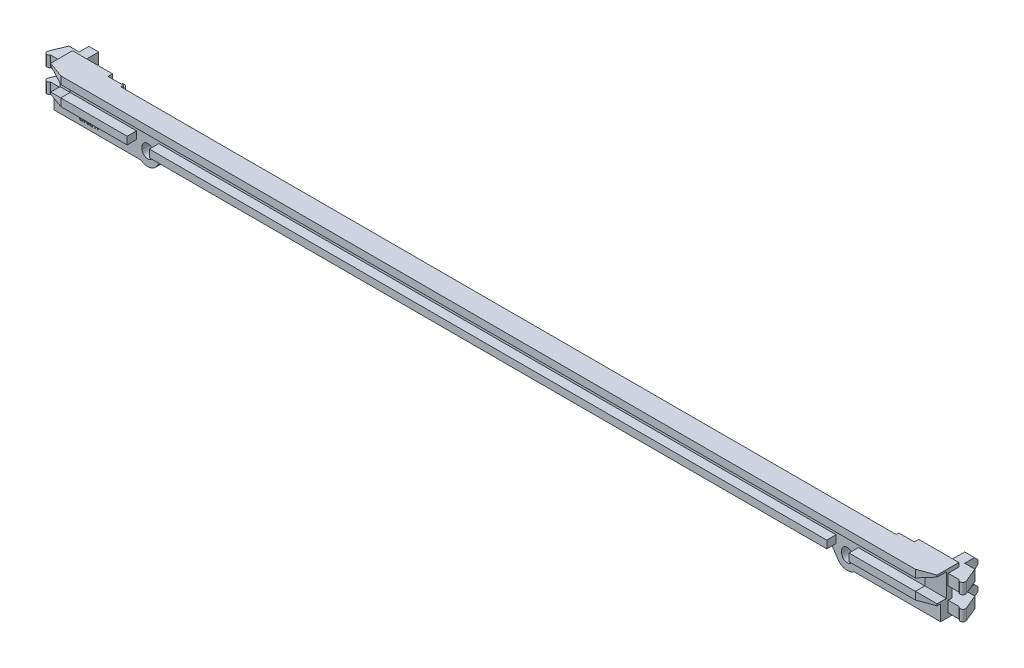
SolidWorks part; units mm, degrees
ref_plane "前视基准面" through (0, 0, 0) normal (0, 0, 1) x (1, 0, 0)
ref_plane "上视基准面" through (0, 0, 0) normal (0, 1, 0) x (1, 0, 0)
ref_plane "右视基准面" through (0, 0, 0) normal (1, 0, 0) x (0, 0, -1)
sketch "草图1" plane through (0, 0, 0) normal (0, 0, 1) x (1, 0, 0)
  line L0 (-73.0423, -1.25) -> (73.0423, -1.25)
  line L1 (-99.65, 4.75) -> (99.65, 4.75)
  line L2 (-99.65, 4.75) -> (-99.65, -4.75)
  line L3 (-99.65, -4.75) -> (-80.15, -4.75)
  line L4 (99.65, 4.75) -> (99.65, -4.75)
  line L5 (-99.65, 4.75) -> (99.65, -4.75) construction
  line L6 (-99.65, -4.75) -> (99.65, 4.75) construction
  line L7 (0, 0) -> (0, 14.6466) construction
  line L8 (-75.5403, -2.5887) -> (-76.5683, -4.1344)
  line L9 (-78.65, -1.75) -> (-78.65, -2.75) construction
  line L10 (80.15, -4.75) -> (99.65, -4.75)
  line L11 (75.5403, -2.5887) -> (76.5683, -4.1344)
  line L12 (-78.65, -2) -> (-78.65, -2.5) construction
  line L13 (-77.4, -2) -> (-77.4, -2.5)
  line L14 (-79.9, -2) -> (-79.9, -2.5)
  line L15 (78.65, -2) -> (78.65, -2.5) construction
  line L16 (77.4, -2) -> (77.4, -2.5)
  line L17 (79.9, -2) -> (79.9, -2.5)
  arc A0 (80.15, -4.75) -> (76.5683, -4.1344) centre (78.65, -2.75) cw
  arc A1 (-80.15, -4.75) -> (-76.5683, -4.1344) centre (-78.65, -2.75) ccw
  arc A2 (-77.4, -2) -> (-79.9, -2) centre (-78.65, -2) ccw
  arc A3 (-79.9, -2.5) -> (-77.4, -2.5) centre (-78.65, -2.5) ccw
  arc A4 (77.4, -2) -> (79.9, -2) centre (78.65, -2) cw
  arc A5 (79.9, -2.5) -> (77.4, -2.5) centre (78.65, -2.5) cw
  arc A6 (75.5403, -2.5887) -> (73.0423, -1.25) centre (73.0423, -4.25) ccw
  arc A7 (-75.5403, -2.5887) -> (-73.0423, -1.25) centre (-73.0423, -4.25) cw
  point P0 (0, 0)
  point P12 (-78.65, -2.25)
  point P19 (-78.65, -2.25)
  point P24 (-78.65, -0.75)
  point P25 (-78.65, -3.75)
  point P31 (78.65, -2.25)
  point P36 (74.65, -1.25)
  point P39 (-74.65, -1.25)
  dimension "D5" = 2.5
  dimension "D8" = 21
  dimension "D11" = 3
  dimension "D9" = 7.5
  dimension "D1" = 199.3
  dimension "D2" = 9.5
  dimension "D3" = 2.5
  dimension "D4" = 3
  dimension "D6" = 5.5
  dimension "D7" = 25
  dimension "D10" = 6
extrude "凸台-拉伸1" add sketch "草图1" along normal blind 2.5
sketch "草图3" plane through (0, 0, 2.5) normal (0, 0, 1) x (1, 0, 0)
  line L0 (99.65, -4.75) -> (99.65, 4.75) construction
  line L1 (-99.65, 4.75) -> (99.65, 4.75)
  line L2 (-99.65, 4.75) -> (-99.65, 3.05)
  line L3 (-99.65, 3.05) -> (99.65, 3.05)
  line L4 (99.65, 4.75) -> (99.65, 3.05)
  line L5 (-99.65, 4.75) -> (-99.65, -4.75) construction
  line L6 (-99.65, 0.45) -> (-81.15, 0.45)
  line L7 (-99.65, 0.45) -> (-99.65, -1.25)
  line L8 (-99.65, -1.25) -> (-81.15, -1.25)
  line L9 (99.65, 0.45) -> (99.65, -1.25)
  line L10 (-73.0423, -1.25) -> (73.0423, -1.25) construction
  line L11 (-81.15, 0.45) -> (-81.15, -1.25)
  line L12 (-76.15, 0.45) -> (-76.15, -1.25)
  line L13 (-76.15, 0.45) -> (76.15, 0.45)
  line L14 (-76.15, -1.25) -> (76.15, -1.25)
  line L15 (76.15, 0.45) -> (76.15, -1.25)
  line L16 (81.15, 0.45) -> (81.15, -1.25)
  line L17 (81.15, 0.45) -> (99.65, 0.45)
  line L18 (81.15, -1.25) -> (99.65, -1.25)
  dimension "D1" = 1.7
  dimension "D2" = 1.7
  dimension "D3" = 18.5
  dimension "D4" = 5
  dimension "D5" = 5
  dimension "D6" = 18.5
extrude "凸台-拉伸2" add sketch "草图3" along normal blind 2.1
sketch "草图4" plane through (0, 0, 0) normal (0, 0, -1) x (-1, 0, 0)
  line L0 (-99.65, 4.75) -> (99.65, 4.75) construction
  line L1 (-78.15, 3.25) -> (-52.9333, 3.25)
  line L2 (-78.15, 3.25) -> (-78.15, 0.15)
  line L3 (-78.15, 0.15) -> (-52.9333, 0.15)
  line L4 (-52.9333, 3.25) -> (-52.9333, 0.15)
  line L5 (-78.15, 3.25) -> (-52.9333, 0.15) construction
  line L6 (-78.15, 0.15) -> (-52.9333, 3.25) construction
  line L7 (73.0423, -1.25) -> (-73.0423, -1.25) construction
  line L8 (-51.9333, 3.25) -> (-26.7167, 3.25)
  line L9 (-51.9333, 3.25) -> (-51.9333, 0.15)
  line L10 (-51.9333, 0.15) -> (-26.7167, 0.15)
  line L11 (-26.7167, 3.25) -> (-26.7167, 0.15)
  line L12 (-51.9333, 3.25) -> (-26.7167, 0.15) construction
  line L13 (-51.9333, 0.15) -> (-26.7167, 3.25) construction
  line L14 (-25.7167, 3.25) -> (-0.5, 3.25)
  line L15 (-25.7167, 3.25) -> (-25.7167, 0.15)
  line L16 (-25.7167, 0.15) -> (-0.5, 0.15)
  line L17 (-0.5, 3.25) -> (-0.5, 0.15)
  line L18 (-25.7167, 3.25) -> (-0.5, 0.15) construction
  line L19 (-25.7167, 0.15) -> (-0.5, 3.25) construction
  line L20 (0.5, 3.25) -> (25.7167, 3.25)
  line L21 (0.5, 3.25) -> (0.5, 0.15)
  line L22 (0.5, 0.15) -> (25.7167, 0.15)
  line L23 (25.7167, 3.25) -> (25.7167, 0.15)
  line L24 (0.5, 3.25) -> (25.7167, 0.15) construction
  line L25 (0.5, 0.15) -> (25.7167, 3.25) construction
  line L26 (26.7167, 3.25) -> (51.9333, 3.25)
  line L27 (26.7167, 3.25) -> (26.7167, 0.15)
  line L28 (26.7167, 0.15) -> (51.9333, 0.15)
  line L29 (51.9333, 3.25) -> (51.9333, 0.15)
  line L30 (26.7167, 3.25) -> (51.9333, 0.15) construction
  line L31 (26.7167, 0.15) -> (51.9333, 3.25) construction
  line L32 (52.9333, 3.25) -> (78.15, 3.25)
  line L33 (52.9333, 3.25) -> (52.9333, 0.15)
  line L34 (52.9333, 0.15) -> (78.15, 0.15)
  line L35 (78.15, 3.25) -> (78.15, 0.15)
  line L36 (52.9333, 3.25) -> (78.15, 0.15) construction
  line L37 (52.9333, 0.15) -> (78.15, 3.25) construction
  line L38 (99.65, 4.75) -> (99.65, -4.75) construction
  line L39 (80.9, -3.35) -> (97.45, -3.35)
  line L40 (79.15, 0.1937) -> (79.15, 3.25)
  line L41 (79.15, 3.25) -> (97.45, 3.25)
  line L42 (97.45, -3.35) -> (97.45, 3.25)
  line L43 (0, 0) -> (0, 14.3105) construction
  line L44 (79.15, 3.25) -> (97.45, -3.35) construction
  line L45 (99.65, -4.75) -> (80.15, -4.75) construction
  line L46 (80.9, -2) -> (80.9, -3.35)
  line L47 (-80.9, -3.35) -> (-97.45, -3.35)
  line L48 (-97.45, -3.35) -> (-97.45, 3.25)
  line L49 (-79.15, 3.25) -> (-97.45, 3.25)
  line L50 (-80.9, -2) -> (-80.9, -3.35)
  line L51 (-79.15, 0.1937) -> (-79.15, 3.25)
  arc A0 (-77.4, -2) -> (-79.9, -2) centre (-78.65, -2) ccw construction
  arc A1 (79.9, -2) -> (77.4, -2) centre (78.65, -2) ccw construction
  arc A2 (80.9, -2) -> (79.15, 0.1937) centre (78.65, -2) ccw
  arc A3 (-80.9, -2) -> (-79.15, 0.1937) centre (-78.65, -2) cw
  point P0 (-65.5417, 1.7)
  point P13 (-39.325, 1.7)
  point P18 (-13.1083, 1.7)
  point P23 (13.1083, 1.7)
  point P28 (39.325, 1.7)
  point P33 (65.5417, 1.7)
  dimension "D3" = 0.5
  dimension "D5" = 0.5
  dimension "D11" = 1
  dimension "D1" = 1.5
  dimension "D2" = 1.4
  dimension "D4" = 6
  dimension "D6" = 1
  dimension "D7" = 1.5
  dimension "D8" = 2.2
  dimension "D9" = 1
  dimension "D10" = 1.4
extrude "切除-拉伸1" cut sketch "草图4" against normal blind 1.6
ref_plane "基准面1" through (0, 3.85, 0) normal (0, 1, 0) x (1, 0, 0)
sketch "草图5" plane through (0, 3.85, 0) normal (0, 1, 0) x (1, 0, 0)
  line L0 (97.35, 0) -> (99.65, 0)
  line L1 (80.15, 0) -> (99.65, 0) construction
  line L2 (99.65, 0) -> (99.65, -0.8)
  line L3 (99.65, -2.5) -> (99.65, 0) construction
  line L4 (99.65, -0.8) -> (102.1304, -0.8)
  line L5 (103.2043, -0.2704) -> (101.85, 3)
  line L6 (101.85, 3) -> (99.55, 3)
  line L7 (99.55, 3) -> (99.55, 6)
  line L8 (99.55, 6) -> (97.35, 6)
  line L9 (97.35, 6) -> (97.35, 0)
  line L11 (0, 0) -> (0, 16.9322) construction
  line L12 (-97.35, 6) -> (-97.35, 0)
  line L13 (-99.55, 6) -> (-97.35, 6)
  line L14 (-99.55, 3) -> (-99.55, 6)
  line L15 (-101.85, 3) -> (-99.55, 3)
  line L16 (-103.2043, -0.2704) -> (-101.85, 3)
  line L17 (-99.65, -0.8) -> (-102.1304, -0.8)
  line L18 (-99.65, 0) -> (-99.65, -0.8)
  line L19 (-97.35, 0) -> (-99.65, 0)
  line L23 (99.65, -4.6) -> (-99.65, -4.6) construction
  arc A0 (102.1304, -0.8) -> (103.2043, -0.2704) centre (102.65, -0.5) ccw
  arc A1 (-102.1304, -0.8) -> (-103.2043, -0.2704) centre (-102.65, -0.5) cw
  point P17 (99.65, -1.25)
  dimension "D9" = 0.6
  dimension "D1" = 10.6
  dimension "D2" = 3.8
  dimension "D3" = 0.3
  dimension "D4" = 2.3
  dimension "D5" = 2.2
  dimension "D6" = 3
  dimension "D7" = 4.5
  dimension "D8" = 3
extrude "凸台-拉伸3" add sketch "草图5" against normal blind 2.45
mirror "镜向1" about plane through (0, 0, 0) normal (0, 1, 0) of "凸台-拉伸3"
sketch "草图6" plane through (0, 0, 0) normal (0, 0, -1) x (-1, 0, 0)
  line L0 (97.45, 3.25) -> (79.15, 3.25) construction
  line L1 (99.65, 4.75) -> (87.15, 4.75)
  line L2 (99.65, 4.75) -> (99.65, 3.25)
  line L3 (99.65, 3.25) -> (87.15, 3.25)
  line L4 (87.15, 4.75) -> (87.15, 3.25)
  line L5 (80.9, -3.35) -> (97.45, -3.35) construction
  line L6 (99.65, -4.75) -> (87.15, -4.75)
  line L7 (99.65, -4.75) -> (99.65, -3.35)
  line L8 (99.65, -3.35) -> (87.15, -3.35)
  line L9 (87.15, -4.75) -> (87.15, -3.35)
  line L10 (-79.15, 3.25) -> (-97.45, 3.25) construction
  line L11 (-99.65, 4.75) -> (-87.15, 4.75)
  line L12 (-99.65, 4.75) -> (-99.65, 3.25)
  line L13 (-99.65, 3.25) -> (-87.15, 3.25)
  line L14 (-87.15, 4.75) -> (-87.15, 3.25)
  line L15 (-97.35, -3.35) -> (-80.9, -3.35) construction
  line L16 (-99.65, -4.75) -> (-87.15, -4.75)
  line L17 (-99.65, -4.75) -> (-99.65, -3.35)
  line L18 (-99.65, -3.35) -> (-87.15, -3.35)
  line L19 (-87.15, -4.75) -> (-87.15, -3.35)
  dimension "D1" = 12.5
  dimension "D2" = 12.5
  dimension "D3" = 12.5
  dimension "D4" = 12.5
extrude "凸台-拉伸4" add sketch "草图6" along normal blind 0.6
sketch "草图7" plane through (0, 0, -0.6) normal (0, 0, -1) x (-1, 0, 0)
  line L0 (-79.15, 3.25) -> (-97.45, 3.25) construction
  line L1 (-99.65, 4.75) -> (-90.65, 4.75)
  line L2 (-99.65, 4.75) -> (-99.65, 3.25)
  line L3 (-99.65, 3.25) -> (-90.65, 3.25)
  line L4 (-90.65, 4.75) -> (-90.65, 3.25)
  line L5 (-87.15, -3.35) -> (-97.35, -3.35) construction
  line L6 (-99.65, -4.75) -> (-90.65, -4.75)
  line L7 (-99.65, -4.75) -> (-99.65, -3.35)
  line L8 (-99.65, -3.35) -> (-90.65, -3.35)
  line L9 (-90.65, -4.75) -> (-90.65, -3.35)
  line L10 (97.45, 3.25) -> (79.15, 3.25) construction
  line L11 (99.65, 4.75) -> (90.65, 4.75)
  line L12 (99.65, 4.75) -> (99.65, 3.25)
  line L13 (99.65, 3.25) -> (90.65, 3.25)
  line L14 (90.65, 4.75) -> (90.65, 3.25)
  line L15 (80.9, -3.35) -> (97.45, -3.35) construction
  line L16 (99.65, -4.75) -> (90.65, -4.75)
  line L17 (99.65, -4.75) -> (99.65, -3.35)
  line L18 (99.65, -3.35) -> (90.65, -3.35)
  line L19 (90.65, -4.75) -> (90.65, -3.35)
  dimension "D1" = 9
extrude "凸台-拉伸5" add sketch "草图7" along normal blind 1
chamfer "倒角1" distance 1.3 angle 70 10 edges at (99.65, 3.9, 4.6) (99.65, -0.4, 4.6) (99.65, 0.45, 3.55) (-99.65, -0.4, 4.6) (-99.65, 0.45, 3.55) (-99.65, 3.9, 4.6)
chamfer "倒角2" distance 0.8 angle 45 12 edges at (98.45, -3.85, -6) (97.35, -2.625, -6) (98.45, -1.4, -6) (98.45, 1.4, -6) (97.35, 2.625, -6) (98.45, 3.85, -6) (-98.45, -3.85, -6) (-97.35, -2.625, -6) (-98.45, -1.4, -6) (-98.45, 1.4, -6) (-97.35, 2.625, -6) (-98.45, 3.85, -6)
sketch "草图9" plane through (0, 0, 0) normal (0, 1, 0) x (1, 0, 0)
  line L0 (-90.9, 4.1) -> (-90.9, -1.6)
  line L1 (-80.9, -1.6) -> (-97.45, -1.6) construction
  line L2 (-90.9, -1.6) -> (-88.9, -1.6)
  line L3 (-88.9, -1.6) -> (-89.5897, 3.3078)
  line L4 (-90.2, 4.1) -> (-90.9, 4.1)
  line L5 (-90.2, 4.1) -> (-89.5897, 3.3078)
  line L6 (96.0783, -4.6) -> (-96.0783, -4.6) construction
  line L7 (-99.65, -3.3) -> (-99.65, 1.6) construction
  line L8 (0, 0) -> (0, 15.3008) construction
  line L9 (90.2, 4.1) -> (89.5897, 3.3078)
  line L10 (90.2, 4.1) -> (90.9, 4.1)
  line L11 (88.9, -1.6) -> (89.5897, 3.3078)
  line L12 (90.9, -1.6) -> (88.9, -1.6)
  line L13 (90.9, 4.1) -> (90.9, -1.6)
  dimension "D1" = 8.7
  dimension "D2" = 8.75
  dimension "D3" = 2
  dimension "D4" = 0.7
  dimension "D5" = 8
  dimension "D6" = 1
extrude "凸台-拉伸6" add sketch "草图9" along normal mid plane 3
sketch "草图10" plane through (0, 0, 2.5) normal (0, 0, 1) x (1, 0, 0)
  line L0 (-53.0759, -2.25) -> (-94.15, -2.25) construction
  line L2 (-99.65, -1.25) -> (-81.15, -1.25) construction
  line L3 (-99.65, -1.25) -> (-99.65, -4.75) construction
  text T0 "KONO" font "黑体" height 1.5
  dimension "D1" = 1
  dimension "D2" = 5.5
extrude "切除-拉伸2" cut sketch "草图10" against normal blind 0.2
